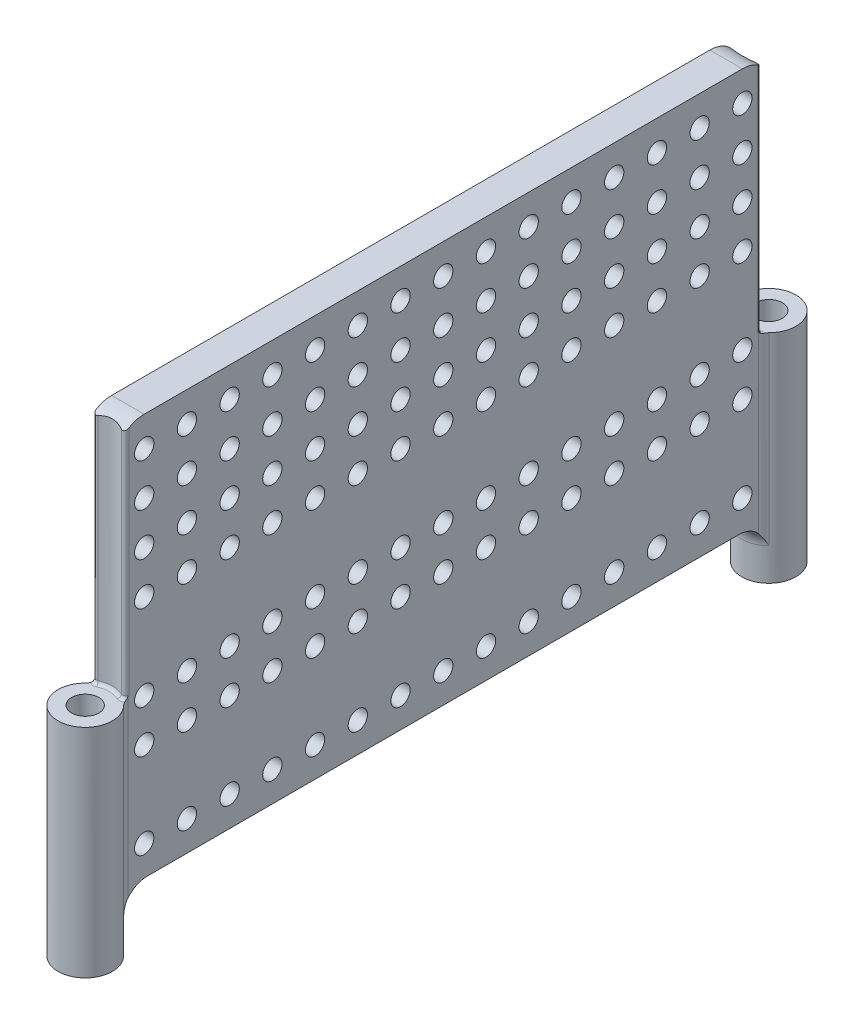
SolidWorks part; units mm, degrees
ref_plane "Front Plane" through (0, 0, 0) normal (0, 0, 1) x (1, 0, 0)
ref_plane "Top Plane" through (0, 0, 0) normal (0, 1, 0) x (1, 0, 0)
ref_plane "Right Plane" through (0, 0, 0) normal (1, 0, 0) x (0, 0, -1)
sketch "Sketch1" plane through (0, 0, 0) normal (0, 1, 0) x (1, 0, 0)
  line L0 (-1.905, 37.46) -> (-1.905, -37.46)
  line L1 (0, 40) -> (0, -40) construction
  line L2 (1.905, 37.46) -> (1.905, -37.46)
  line L5 (-8.8239, 0) -> (17.0915, 0) construction
  arc A0 (1.905, 37.46) -> (-1.905, 37.46) centre (0, 40) ccw
  arc A1 (1.905, -37.46) -> (-1.905, -37.46) centre (0, -40) cw
  point P0 (0, 0)
  point P1 (0, 0)
  point P9 (0, 0)
  point P11 (0, 0)
  point P12 (0, 0)
  dimension "D1" = 6.35
  dimension "D2" = 80
  dimension "D3" = 3.81
extrude "Boss-Extrude1" add sketch "Sketch1" along normal blind 53.35
sketch "Sketch8" plane through (0, 0, 0) normal (1, 0, 0) x (0, 0, -1)
  line L0 (-37.46, 53.35) -> (-43.175, 53.35) construction
  line L1 (-43.175, 53.35) -> (-38.5, 53.35)
  line L2 (-43.175, 53.35) -> (-43.175, 25.4)
  line L3 (-43.175, 25.4) -> (-38.5, 25.4)
  line L4 (-38.5, 53.35) -> (-38.5, 25.4)
  line L5 (0, 0) -> (0, 63.384) construction
  line L6 (-43.175, 0) -> (-37.46, 0) construction
  line L8 (43.175, 53.35) -> (38.5, 53.35)
  line L9 (43.175, 53.35) -> (43.175, 25.4)
  line L10 (43.175, 25.4) -> (38.5, 25.4)
  line L11 (38.5, 53.35) -> (38.5, 25.4)
  line L12 (-37.46, 53.35) -> (-37.46, 0) construction
  line L13 (-37.46, 0) -> (37.46, 0)
  line L14 (-37.46, 0) -> (-37.46, 6.35)
  line L15 (-37.46, 6.35) -> (37.46, 6.35)
  line L16 (37.46, 0) -> (37.46, 6.35)
  line L17 (37.46, 53.35) -> (37.46, 0) construction
  line L18 (-37.46, 0) -> (37.46, 0) construction
  point P10 (-40.8375, 25.4)
  dimension "D1" = 25.4
  dimension "D2" = 6.35
  dimension "D3" = 77
extrude "Cut-Extrude4" cut sketch "Sketch8" against normal through all both and the other way through all
sketch "Sketch15" plane through (0, 53.35, 0) normal (0, 1, 0) x (1, 0, 0)
  line L2 (-1.905, -37.46) -> (-1.905, -38.5)
  line L3 (-2.7983, -38.5) -> (2.7983, -38.5)
  line L4 (-2.7983, -38.5) -> (-1.905, -38.5)
  line L5 (1.905, -37.46) -> (1.905, -38.5)
  line L6 (1.905, -38.5) -> (2.7983, -38.5)
  line L9 (-1.905, 37.46) -> (-1.905, 38.5)
  line L10 (2.7983, 38.5) -> (-2.7983, 38.5)
  line L11 (2.7983, 38.5) -> (1.905, 38.5)
  line L12 (1.905, 37.46) -> (1.905, 38.5)
  line L13 (-1.905, 38.5) -> (-2.7983, 38.5)
  arc A6 (2.7983, -38.5) -> (1.905, -37.46) centre (0, -40) ccw
  arc A7 (-1.905, -37.46) -> (-2.7983, -38.5) centre (0, -40) ccw
  arc A8 (2.7983, -38.5) -> (1.905, -37.46) centre (0, -40) ccw
  arc A9 (-1.905, -37.46) -> (-2.7983, -38.5) centre (0, -40) ccw
  arc A14 (1.905, 37.46) -> (2.7983, 38.5) centre (0, 40) ccw
  arc A15 (-2.7983, 38.5) -> (-1.905, 37.46) centre (0, 40) ccw
  arc A16 (1.905, 37.46) -> (2.7983, 38.5) centre (0, 40) ccw
  arc A17 (-2.7983, 38.5) -> (-1.905, 37.46) centre (0, 40) ccw
  dimension "D1" = 0
  dimension "D2" = 0
extrude "Cut-Extrude5" cut sketch "Sketch15" against normal up to surface (27.95 mm away)
sketch "Sketch11" plane through (0, 0, 0) normal (0, -1, 0) x (1, 0, 0)
  line L0 (-1.905, 37.46) -> (1.905, 37.46)
  line L1 (-1.905, 37.46) -> (1.905, 37.46) construction
  line L2 (-1.905, -37.46) -> (1.905, -37.46)
  line L3 (-1.905, -37.46) -> (1.905, -37.46) construction
  arc A0 (-1.905, 37.46) -> (1.905, 37.46) centre (0, 40) ccw
  arc A2 (1.905, 37.46) -> (-1.905, 37.46) centre (0, 40) ccw construction
  arc A4 (-1.905, -37.46) -> (1.905, -37.46) centre (0, -40) cw
  arc A5 (-1.905, -37.46) -> (1.905, -37.46) centre (0, -40) ccw construction
extrude "Boss-Extrude2" add sketch "Sketch11" against normal up to surface (6.35 mm away)
hole_wizard "1/8 (0.125) Diameter Hole2" positions "Sketch9" profile "Sketch10" hole size "1/8" standard "ANSI Inch"
sketch "Sketch9" plane through (0, 25.4, 0) normal (0, 1, 0) x (1, 0, 0)
  point P0 (0, 40)
  point P3 (0, -40)
sketch "Sketch10" plane through (0, 25.4, -40) normal (1, 0, 0) x (0, 0, 1)
  line L0 (0, 0) -> (0, 25.4)
  line L1 (0, 25.4) -> (1.5875, 25.4)
  line L2 (1.5875, 25.4) -> (1.5875, 0)
  line L5 (1.5875, 0) -> (0, 0)
  line L11 (0, -6.35) -> (0, 107.95) construction
  dimension "Thru Hole Dia." = 3.175
  dimension "Thru Hole Depth" = 25.4
fillet "Fillet10" radius 2.54 2 edges at (0, 6.35, -36.825) (0, 6.35, 36.825)
fillet "Fillet11" radius 3.5 2 edges at (0, 53.35, 38.5) (0, 53.35, -38.5)
hole_wizard "#4-40 Tapped Hole1" positions "Sketch12" profile "Sketch13" tap size "#4-40" standard "ANSI Inch"
sketch "Sketch12" plane through (1.905, 0, 0) normal (1, 0, 0) x (0, 0, -1)
  line L3 (35, 53.35) -> (-35, 53.35) construction
  line L4 (38.5, 49.85) -> (38.5, 25.4) construction
  point P0 (35, 49.85)
  point P3 (35, 19.85)
  point P26 (35, 9.85)
  point P28 (35, 24.85)
  point P30 (35, 34.85)
  point P38 (35, 39.85)
  point P59 (35, 44.85)
  point P60 (0, 0)
  dimension "D1" = 30
  dimension "D2" = 40
  dimension "D3" = 25
  dimension "D4" = 25
  dimension "D5" = 30
  dimension "D6" = 3.5
  dimension "D7" = 3.5
  dimension "D8" = 35
sketch "Sketch13" plane through (1.905, 49.85, -35) normal (0, 1, 0) x (0, 0, -1)
  line L0 (0, 0) -> (0, 5.08)
  line L1 (0, 5.08) -> (1.1303, 5.08)
  line L2 (1.1303, 5.08) -> (1.1303, 0)
  line L5 (1.1303, 0) -> (0, 0)
  line L11 (0, -6.35) -> (0, 107.95) construction
  dimension "Thread Major Dia." = 2.2606
  dimension "Thru Tap Drill Depth" = 5.08
pattern_linear "LPattern1" count 15 spacing 5 along (0, 0, 1) of "#4-40 Tapped Hole1"
sketch "Sketch16" plane through (0, 25.4, 0) normal (0, 1, 0) x (1, 0, 0)
  circle A0 centre (0, -40) radius 3.175
  arc A2 (-1.905, -37.46) -> (1.905, -37.46) centre (0, -40) ccw construction
  circle A3 centre (0, 40) radius 3.175
  arc A4 (1.905, 37.46) -> (-1.905, 37.46) centre (0, 40) ccw construction
extrude "Cut-Extrude6" cut sketch "Sketch16" along normal through all
fillet "Fillet13" radius 0.381 4 edges at (1.905, 38.8698, 37.46) (-1.905, 38.8698, 37.46) (1.905, 38.8698, -37.46) (-1.905, 38.8698, -37.46)
fillet "Fillet12" radius 1.27 4 edges at (-1.905, 14.605, -37.46) (1.905, 14.605, -37.46) (-1.905, 14.605, 37.46) (1.905, 14.605, 37.46)
fillet "Fillet14" radius 0.381 6 edges at (-1.7277, 25.4, -37.1091) (1.7277, 25.4, -37.1091) (1.7277, 25.4, 37.1091) (-1.7277, 25.4, 37.1091) (0, 25.4, -36.825) (0, 25.4, 36.825)
